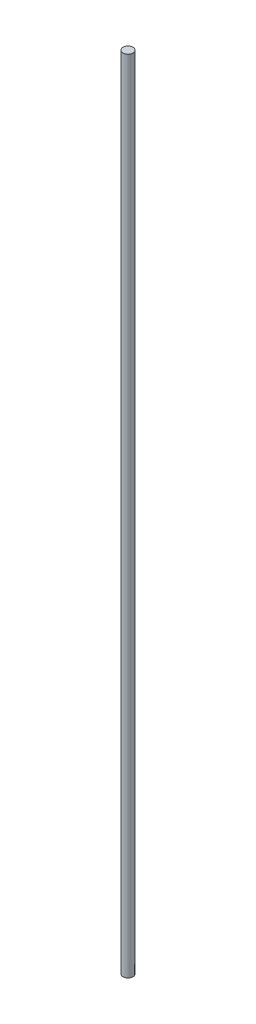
SolidWorks part; units mm, degrees
ref_plane "正面" through (0, 0, 0) normal (0, 0, 1) x (1, 0, 0)
ref_plane "平面" through (0, 0, 0) normal (0, 1, 0) x (1, 0, 0)
ref_plane "右側面" through (0, 0, 0) normal (1, 0, 0) x (0, 0, -1)
sketch "ｽｹｯﾁ1" plane through (0, 0, 0) normal (0, 1, 0) x (1, 0, 0)
  circle A0 centre (0, 0) radius 4.826
  dimension "D1" = 9.652
extrude "ﾎﾞｽ - 押し出し1" add sketch "ｽｹｯﾁ1" along normal blind 762
